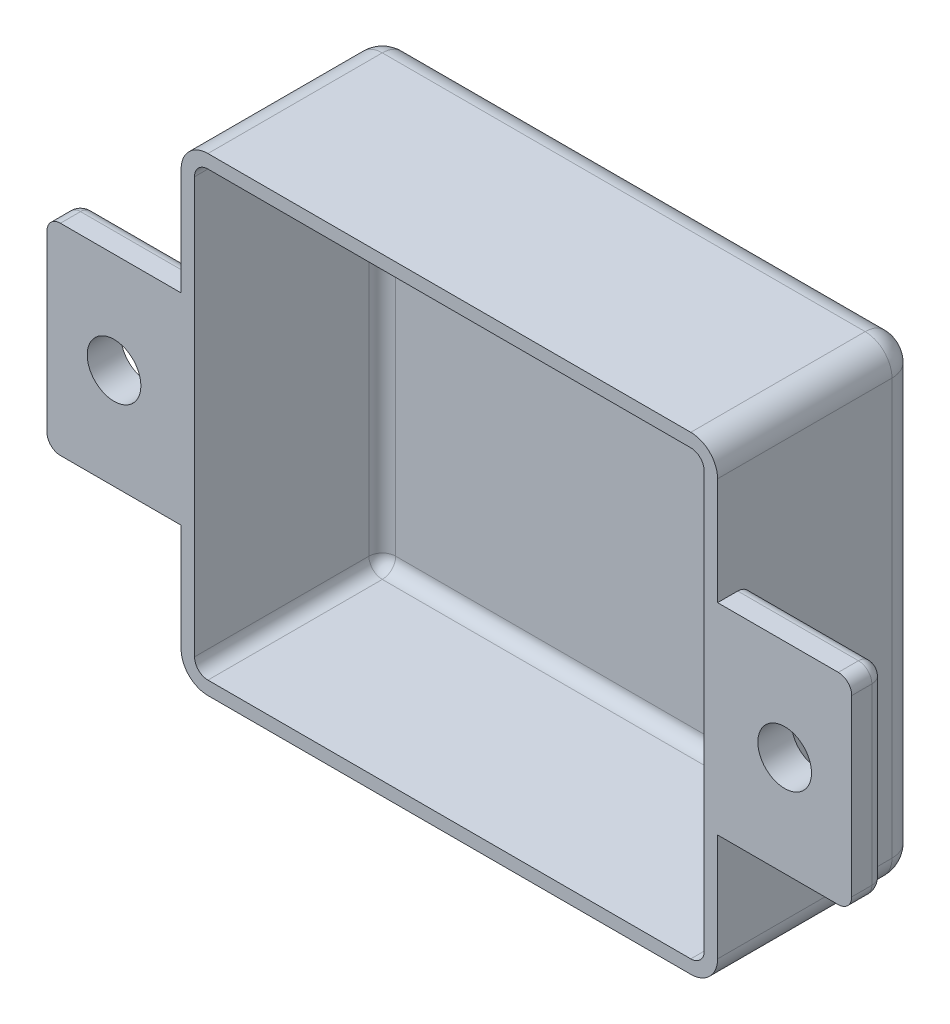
SolidWorks part; units mm, degrees
ref_plane "Front" through (0, 0, 0) normal (0, 0, 1) x (1, 0, 0)
ref_plane "Top" through (0, 0, 0) normal (0, 1, 0) x (1, 0, 0)
ref_plane "Right" through (0, 0, 0) normal (1, 0, 0) x (0, 0, -1)
sketch "Sketch1"
  dimension "D1" = 101.6
  dimension "D2" = 88.9
extrude "Extrude1" add sketch "Sketch1" along normal blind 38.1
fillet "Fillet1" radius 5.08
shell "Shell1" thickness 2.54
sketch "Sketch2"
  dimension "D1" = 25.4
  dimension "D2" = 38.1
extrude "Extrude2" add sketch "Sketch2" against normal blind 6.35
fillet "Fillet2" radius 2.54
sketch "Sketch3"
  dimension "D1" = 10.16
extrude "Cut-Extrude1" cut sketch "Sketch3" against normal through all
mirror "Mirror1"
